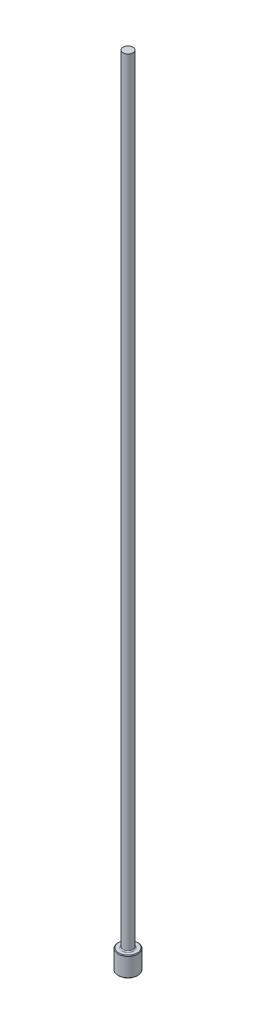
SolidWorks part; units mm, degrees
ref_plane "Front Plane" through (0, 0, 0) normal (0, 0, 1) x (1, 0, 0)
ref_plane "Top Plane" through (0, 0, 0) normal (0, 1, 0) x (1, 0, 0)
ref_plane "Right Plane" through (0, 0, 0) normal (1, 0, 0) x (0, 0, -1)
other "Configuration Table"
sketch "Sketch1" plane through (0, 0, 0) normal (0, 0, 1) x (1, 0, 0)
  line L0 (0, 259.9588) -> (0, -15.1925) construction
  line L1 (0, 0) -> (-0.7874, 0)
  line L2 (-0.7874, 0) -> (-0.7874, 1.5748)
  line L3 (-0.7874, 1.5748) -> (-0.3937, 1.5748)
  line L4 (-0.3937, 1.5748) -> (-0.3937, 63.5)
  line L5 (-0.3937, 63.5) -> (0, 63.5)
  line L6 (0, 63.5) -> (0, 0)
  dimension "L" = 63.5
  dimension "H" = 1.5748
  dimension "T" = 1.5748
  dimension "D" = 0.7874
revolve "Revolve1" add sketch "Sketch1" angle 360 about L0
chamfer "Chamfer1" distance 0.0508 angle 45 2 edges at (0, 1.5748, 0.7874) (0, 0, 0.7874)
fillet "Fillet1" radius 0.0762 1 edges at (0, 1.5748, 0.3937)
